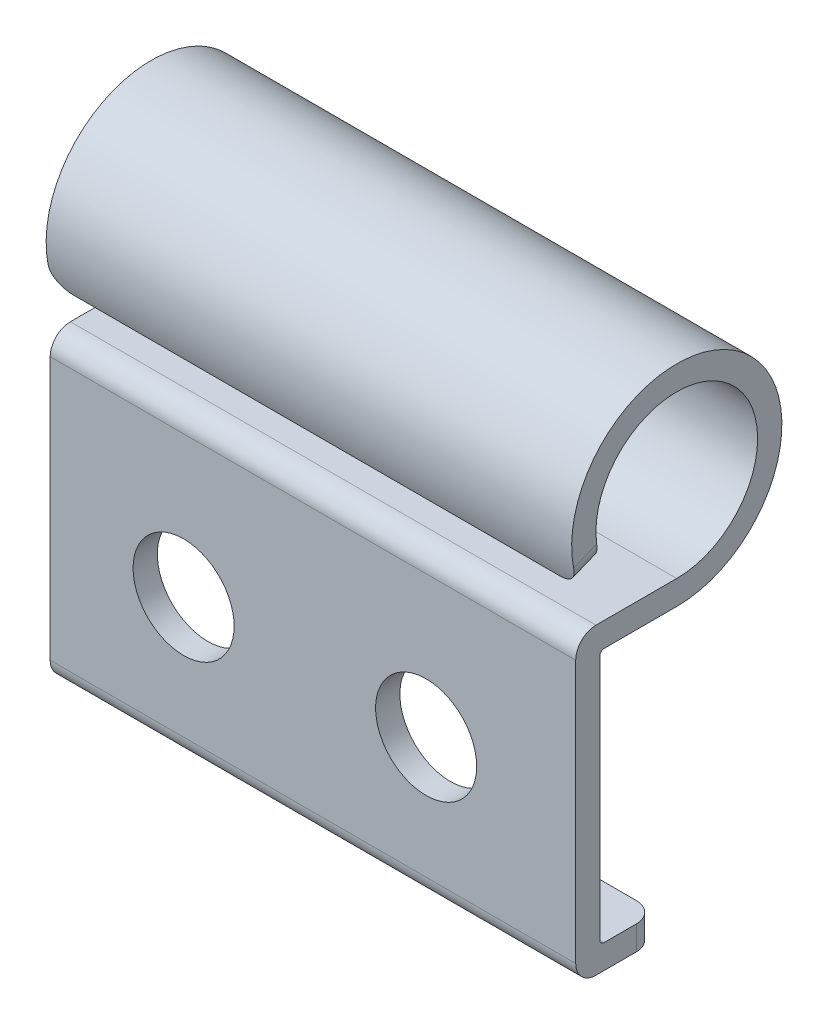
SolidWorks part; units mm, degrees
ref_plane "Front Plane" through (0, 0, 0) normal (0, 0, 1) x (1, 0, 0)
ref_plane "Top Plane" through (0, 0, 0) normal (0, 1, 0) x (1, 0, 0)
ref_plane "Right Plane" through (0, 0, 0) normal (1, 0, 0) x (0, 0, -1)
sketch "Sketch1" plane through (0, 0, 0) normal (1, 0, 0) x (0, 0, -1)
  line L0 (-0.5, -9.5) -> (-2, -9.5)
  line L1 (-2.5, -9) -> (-2.5, -2.5)
  line L2 (-2, -2) -> (0, -2)
  arc A0 (-2, -9.5) -> (-2.5, -9) centre (-2, -9) cw
  arc A1 (-2.5, -2.5) -> (-2, -2) centre (-2, -2.5) cw
  arc A2 (0, -2) -> (-1.8507, -0.7581) centre (0, 0) ccw
  dimension "D1" = 0.5
  dimension "D4" = 9.5
  dimension "D2" = 0.5
  dimension "D3" = 4
  dimension "D5" = 2
  dimension "D6" = 2.5
extrude "Extrude-Thin1" add sketch "Sketch1" along normal blind 13 thin
sketch "Sketch2" plane through (0, 0, 2.5) normal (0, 0, -1) x (-1, 0, 0)
  line L2 (0, -9) -> (0, -2.5) construction
  circle A0 centre (-3.3, -6) radius 1.25
  circle A1 centre (-9.3, -6) radius 1.25
  dimension "D1" = 2.5
  dimension "D3" = 3.3
  dimension "D6" = 6
  dimension "D4" = 9.3
  dimension "D5" = 2.5
  dimension "D2" = 6
extrude "Cut-Extrude1" cut sketch "Sketch2" along normal up to next
fillet "Fillet1" radius 0.5 4 edges at (0, -0.8719, 2.1284) (13, -0.8719, 2.1284) (0, -9.2, 0.5) (13, -9.2, 0.5)
fillet "Fillet2" radius 0.1 2 edges at (6.5, -8.9, 1.9) (6.5, -2.6, 1.9)
